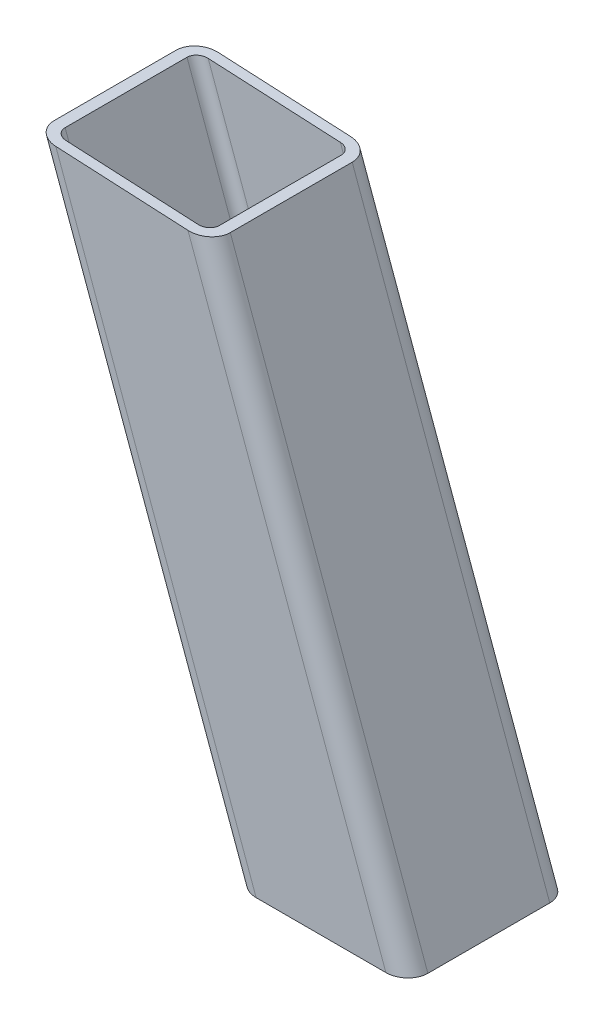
SolidWorks part; units mm, degrees
ref_plane "Płaszczyzna przednia" through (0, 0, 0) normal (0, 0, 1) x (1, 0, 0)
ref_plane "Płaszczyzna górna" through (0, 0, 0) normal (0, 1, 0) x (1, 0, 0)
ref_plane "Płaszczyzna prawa" through (0, 0, 0) normal (1, 0, 0) x (0, 0, -1)
body saved out of another part "Zapas-odkos 3m-1"
